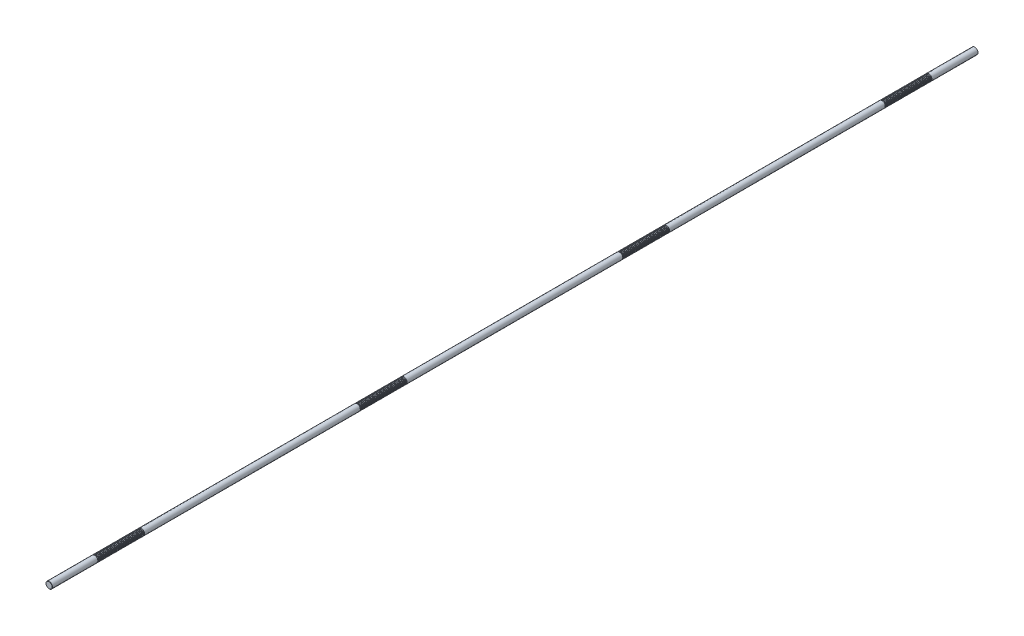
SolidWorks part; units mm, degrees
ref_plane "Front Plane" through (0, 0, 0) normal (0, 0, 1) x (1, 0, 0)
ref_plane "Top Plane" through (0, 0, 0) normal (0, 1, 0) x (1, 0, 0)
ref_plane "Right Plane" through (0, 0, 0) normal (1, 0, 0) x (0, 0, -1)
sketch "Sketch1" plane through (0, 0, 0) normal (0, 0, 1) x (1, 0, 0)
  circle A0 centre (0, 0) radius 7
  dimension "D1" = 14
extrude "Boss-Extrude1" add sketch "Sketch1" along normal mid plane 2000
chamfer "Chamfer1" distance 0.35 angle 45 2 edges at (7, 0, -1000) (7, 0, 1000)
sketch "Sketch2" plane through (0, 0, 0) normal (1, 0, 0) x (0, 0, -1)
  line L0 (900.2345, 7) -> (898.2655, 7)
  line L1 (999.65, 7) -> (-999.65, 7) construction
  line L2 (898.2655, 7) -> (898.7345, 5.25)
  line L3 (898.7345, 5.25) -> (899.7655, 5.25)
  line L4 (899.7655, 5.25) -> (900.2345, 7)
  line L5 (1000, -6.65) -> (1000, 6.65) construction
  point P4 (899.25, 7)
  point P7 (899.25, 5.25)
  point P8 (900, 6.125)
  point P9 (898.5, 6.125)
  dimension "D1" = 1.5
  dimension "D2" = 100
  dimension "D3" = 1.75
  dimension "D4" = 30
revolve "Cut-Revolve1" cut sketch "Sketch2" angle 360 about axis through (0, 0, 1000) along (0, 0, -1)
pattern_linear "LPattern1" count 34 spacing 3 along (0, 0, 1) of "Cut-Revolve1"
pattern_linear "LPattern2" count 4 spacing 567 along (0, 0, 1) of "Cut-Revolve1", "LPattern1"
